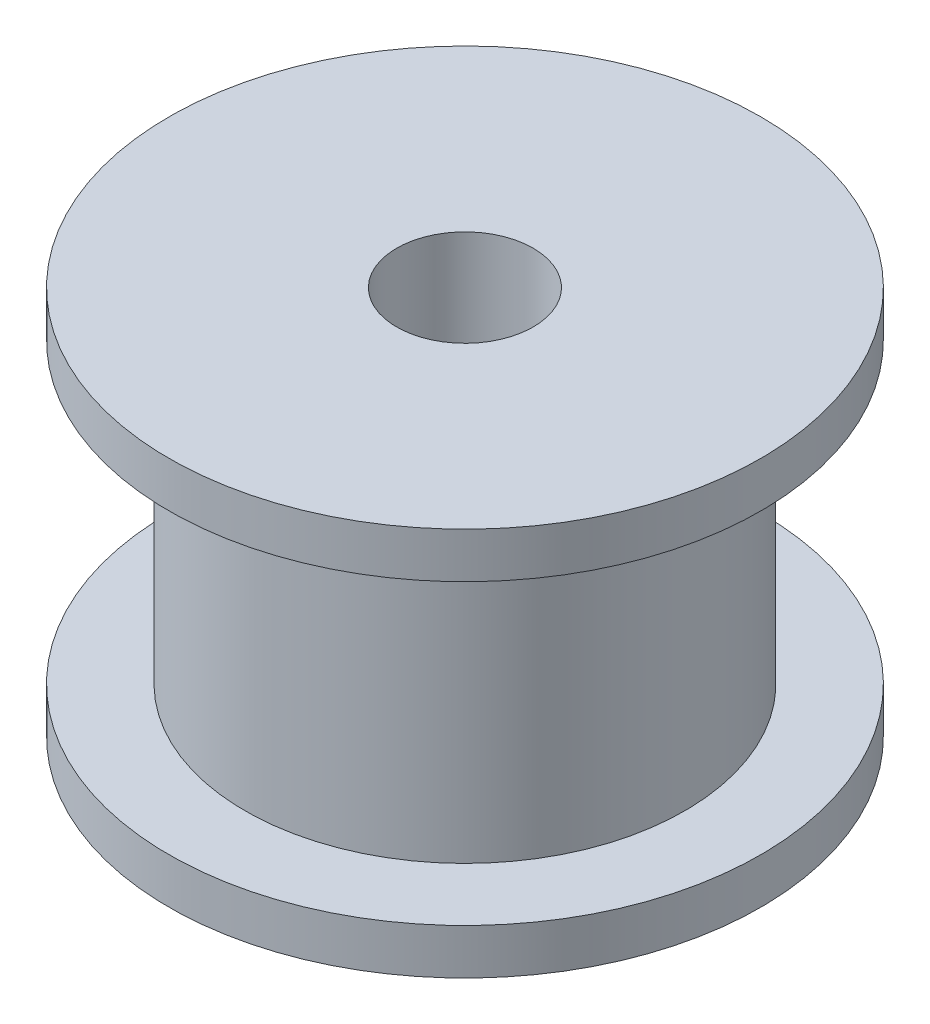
SolidWorks part; units mm, degrees
ref_plane "Front Plane" through (0, 0, 0) normal (0, 0, 1) x (1, 0, 0)
ref_plane "Top Plane" through (0, 0, 0) normal (0, 1, 0) x (1, 0, 0)
ref_plane "Right Plane" through (0, 0, 0) normal (1, 0, 0) x (0, 0, -1)
sketch "Sketch1" plane through (0, 0, 0) normal (0, 0, 1) x (1, 0, 0)
  line L0 (0, 0) -> (1.5, 0) construction
  line L1 (1.5, 0) -> (1.5, 8.54)
  line L2 (1.5, 8.54) -> (6.5, 8.54)
  line L3 (6.5, 8.54) -> (6.5, 7.54)
  line L4 (6.5, 7.54) -> (4.83, 7.54)
  line L5 (4.83, 7.54) -> (4.83, 1)
  line L6 (4.83, 1) -> (6.5, 1)
  line L7 (6.5, 1) -> (6.5, 0)
  line L8 (6.5, 0) -> (1.5, 0)
  line L9 (0, 0) -> (0, 7.9436) construction
  dimension "D1" = 1.5
  dimension "D2" = 6.5
  dimension "D3" = 4.83
  dimension "D4" = 1
  dimension "D5" = 8.54
revolve "Revolve1" add sketch "Sketch1" angle 360 about L9
